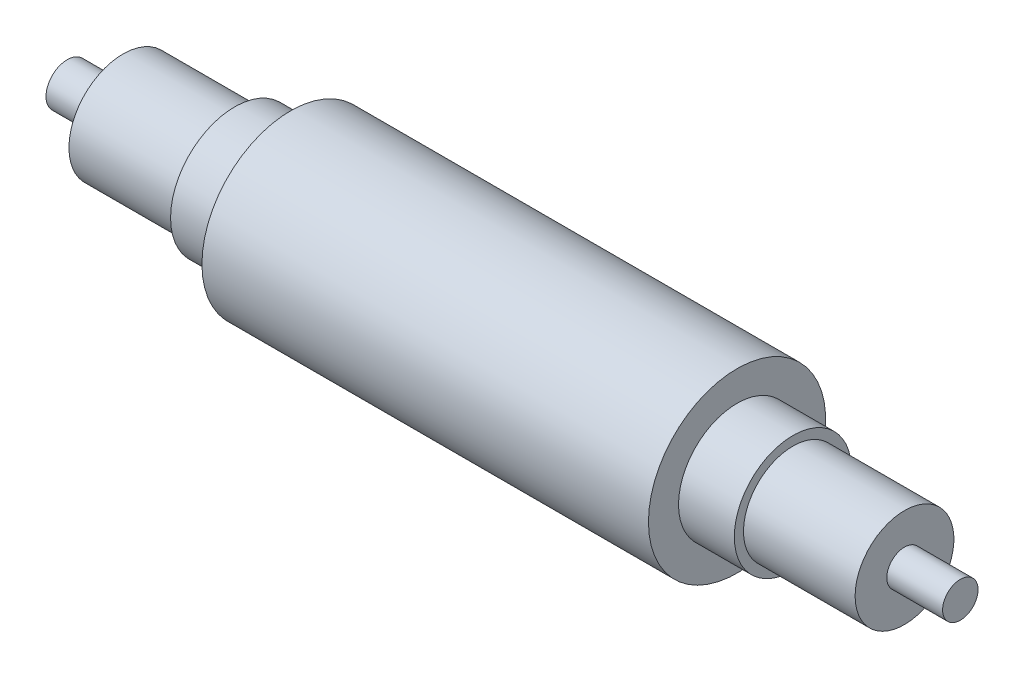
SolidWorks part; units mm, degrees
ref_plane "Front Plane" through (0, 0, 0) normal (0, 0, 1) x (1, 0, 0)
ref_plane "Top Plane" through (0, 0, 0) normal (0, 1, 0) x (1, 0, 0)
ref_plane "Right Plane" through (0, 0, 0) normal (1, 0, 0) x (0, 0, -1)
sketch "Sketch3" plane through (0, 0, 0) normal (0, 0, 1) x (1, 0, 0)
  line L2 (200, -7.9375) -> (200, 7.9375)
  line L3 (200, 7.9375) -> (175, 7.9375)
  line L4 (175, 7.9375) -> (175, 22.12)
  line L5 (175, 22.12) -> (125, 22.12)
  line L6 (125, 22.12) -> (125, 26.22)
  line L7 (125, 26.22) -> (100, 26.22)
  line L8 (100, 26.22) -> (100, 39.6875)
  line L9 (100, 39.6875) -> (0, 39.6875)
  line L10 (0, 39.6875) -> (-100, 39.6875)
  line L11 (-100, 39.6875) -> (-100, 28.73)
  line L12 (-100, 28.73) -> (-125, 28.73)
  line L13 (-125, 28.73) -> (-125, 24.245)
  line L14 (-125, 24.245) -> (-175, 24.245)
  line L15 (-175, 24.245) -> (-175, 9.525)
  line L17 (-200, 7.51) -> (-200, -7.51)
  line L19 (-273.6753, 0) -> (260.9824, 0) construction
  line L20 (-125, -28.73) -> (-125, -24.245)
  line L21 (-100, -28.73) -> (-125, -28.73)
  line L22 (-100, -39.6875) -> (-100, -28.73)
  line L23 (-175, 9.525) -> (-200, 9.525)
  line L24 (-200, 9.525) -> (-200, 7.51)
  line L25 (0, -39.6875) -> (-100, -39.6875)
  line L26 (100, -39.6875) -> (0, -39.6875)
  line L27 (100, -26.22) -> (100, -39.6875)
  line L28 (125, -26.22) -> (100, -26.22)
  line L29 (125, -22.12) -> (125, -26.22)
  line L30 (175, -22.12) -> (125, -22.12)
  line L31 (175, -7.9375) -> (175, -22.12)
  line L32 (200, -7.9375) -> (175, -7.9375)
  line L33 (-200, -9.525) -> (-200, -7.51)
  line L34 (-175, -9.525) -> (-200, -9.525)
  line L35 (-175, -24.245) -> (-175, -9.525)
  line L36 (-125, -24.245) -> (-175, -24.245)
  point P6 (0, 0)
  dimension "D1" = 15.875
  dimension "D2" = 44.24
  dimension "D3" = 52.44
  dimension "D4" = 79.375
  dimension "D5" = 57.46
  dimension "D6" = 48.49
  dimension "D7" = 19.05
revolve "Revolve1" add sketch "Sketch3" angle 360 about L19
